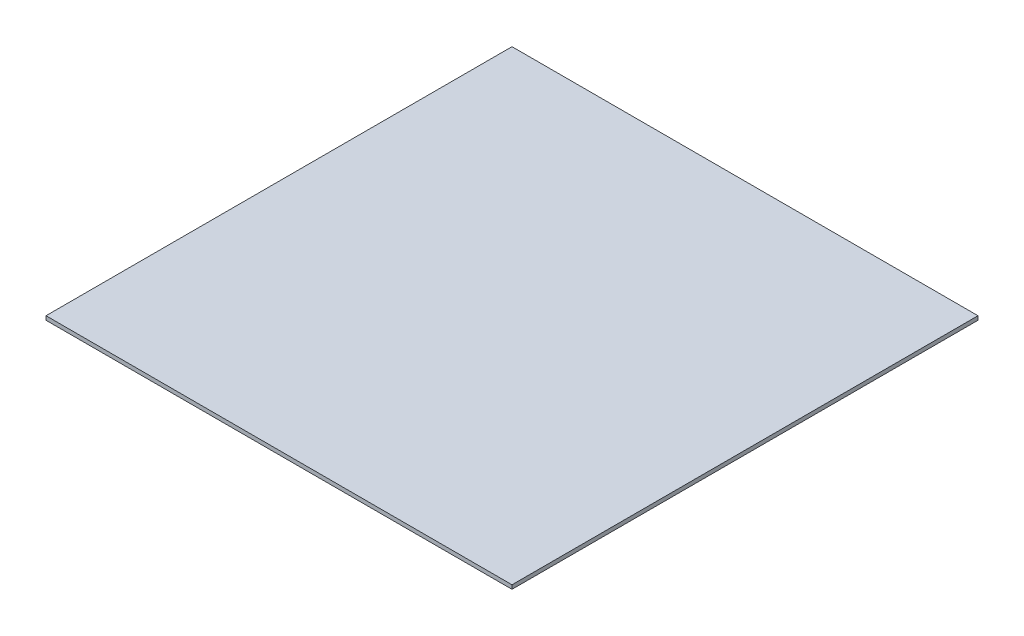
SolidWorks part; units mm, degrees
ref_plane "Front" through (0, 0, 0) normal (0, 0, 1) x (1, 0, 0)
ref_plane "Top" through (0, 0, 0) normal (0, 1, 0) x (1, 0, 0)
ref_plane "Right" through (0, 0, 0) normal (1, 0, 0) x (0, 0, -1)
sketch "Sketch1" plane through (0, 0, 0) normal (0, 1, 0) x (1, 0, 0)
  line L1 (-93.472, -93.472) -> (93.472, -93.472)
  line L2 (-93.472, -93.472) -> (-93.472, 93.472)
  line L3 (-93.472, 93.472) -> (93.472, 93.472)
  line L4 (93.472, -93.472) -> (93.472, 93.472)
  line L5 (-93.472, -93.472) -> (93.472, 93.472) construction
  line L6 (-93.472, 93.472) -> (93.472, -93.472) construction
  point P0 (0, 0)
  dimension "D2" = 186.944
extrude "Boss-Extrude1" add sketch "Sketch1" along normal blind 1.5875
